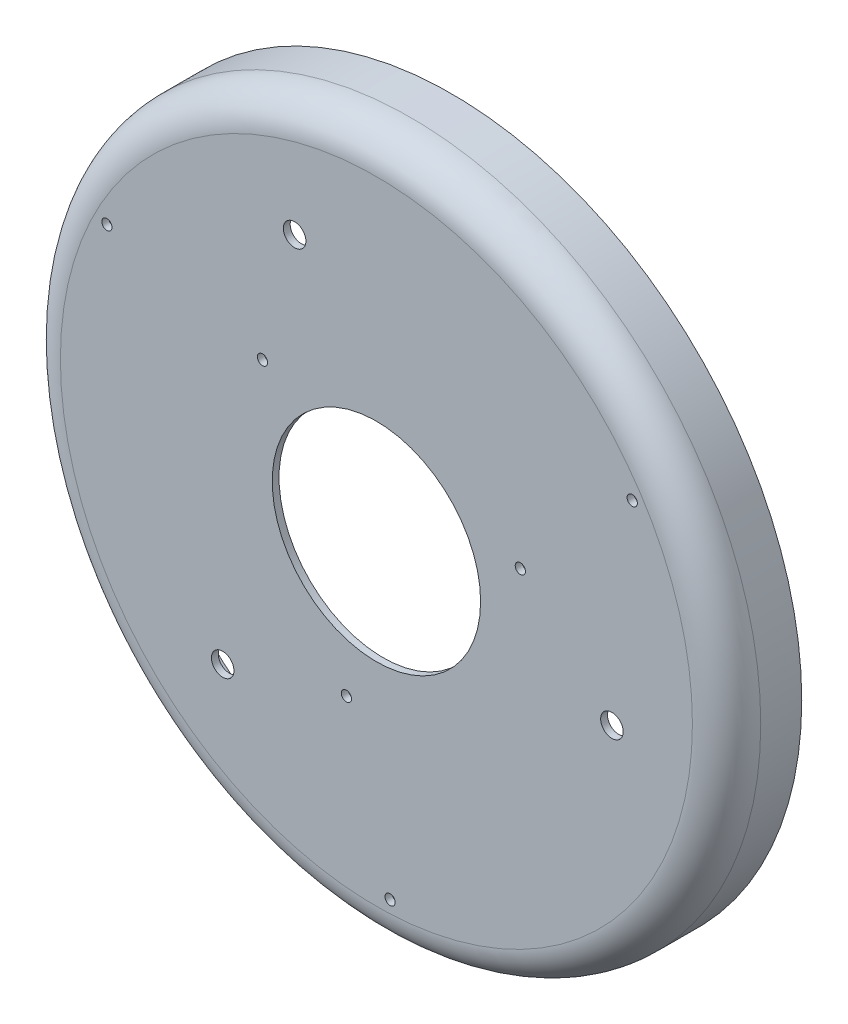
SolidWorks part; units mm, degrees
ref_plane "Face" through (0, 0, 0) normal (0, 0, 1) x (1, 0, 0)
ref_plane "Dessus" through (0, 0, 0) normal (0, 1, 0) x (1, 0, 0)
ref_plane "Droite" through (0, 0, 0) normal (1, 0, 0) x (0, 0, -1)
sketch "Esquisse1" plane through (0, 0, 0) normal (0, 0, 1) x (1, 0, 0)
  circle A0 centre (0, 0) radius 105
  dimension "D1" = 210
extrude "Extrusion1" add sketch "Esquisse1" along normal blind 30
sketch "Esquisse6" plane through (0, 0, 30) normal (0, 0, 1) x (1, 0, 0)
  circle A0 centre (0, 0) radius 102.5
  dimension "D1" = 205
extrude "Extrusion4" cut sketch "Esquisse6" against normal through all flip side to cut
sketch "Esquisse2" plane through (0, 0, 30) normal (0, 0, 1) x (1, 0, 0)
  circle A0 centre (0, 0) radius 30.5
  dimension "D1" = 61
extrude "Extrusion2" cut sketch "Esquisse2" against normal through all
sketch "Esquisse3" plane through (0, 0, 30) normal (0, 0, 1) x (1, 0, 0)
  line L0 (0, 0) -> (-23.9414, 65.7785) construction
  line L1 (0, 0) -> (68.9365, -12.1554) construction
  line L2 (0, 0) -> (-44.9951, -53.6231) construction
  line L3 (0, 0) -> (0, 145.616) construction
  circle A0 centre (0, 0) radius 70 construction
  dimension "D1" = 140
  dimension "D2" = 120
  dimension "D3" = 120
  dimension "D4" = 20
fillet "Congé1" radius 10 1 edges at (102.5, 0, 30)
shell "Coque1" thickness 2
sketch "Esquisse7" plane through (0, 0, 0) normal (0, 0, -1) x (-1, 0, 0)
  circle A0 centre (0, 0) radius 45.8854
extrude "Extrusion5" cut sketch "Esquisse7" against normal up to surface (28 mm away)
hole_wizard "Dégagement M61" positions "Esquisse3D1" profile "Esquisse5" hole size "M6" standard "Ansi Métrique"
sketch3d "Esquisse3D1"
  point P0 (-44.9951, -53.6231, 30)
  point P3 (-23.9414, 65.7785, 30)
  point P6 (68.9365, -12.1554, 30)
sketch "Esquisse5" plane through (-44.9951, -53.6231, 30) normal (1, 0, 0) x (0, -1, 0)
  line L0 (0, 0) -> (0, 30)
  line L1 (0, 30) -> (3.3, 30)
  line L2 (3.3, 30) -> (3.3, 0)
  line L5 (3.3, 0) -> (0, 0)
  line L11 (0, -6.35) -> (0, 107.95) construction
  dimension "Diamètre du perçage jusqu'au prochain" = 6.6
  dimension "Profondeur du perçage jusqu'au prochain" = 30
sketch "Esquisse8" plane through (0, 0, 0) normal (0, 1, 0) x (1, 0, 0)
  line L0 (102.5, 0) -> (102.5, -20)
  line L3 (0, 0) -> (0, -60.3007) construction
  arc A0 (92.5, -30) -> (102.5, -20) centre (92.5, -20) ccw construction
  arc A1 (92.5, -30) -> (102.5, -20) centre (92.5, -20) ccw
revolve "Révol.-Mince1" add sketch "Esquisse8" angle 360 about L3
sketch "Esquisse9" plane through (0, 0, 30) normal (0, 0, 1) x (1, 0, 0)
  line L0 (74.8758, 47.856) -> (0, 0) construction
  circle A0 centre (74.8758, 47.856) radius 1.5
  circle A1 centre (0, 0) radius 88.8627 construction
  dimension "D1" = 3
extrude "Enlèv. mat.-Extru.1" cut sketch "Esquisse9" against normal blind 3
pattern_circular "Répétition circulaire2" count 3 over 360 about axis through (0, 0, 0) along (0, 0, 1) of "Enlèv. mat.-Extru.1"
sketch "Esquisse10" plane through (0, 0, 30) normal (0, 0, 1) x (1, 0, 0)
  circle A0 centre (-33.3475, 29.3943) radius 1.5
extrude "Enlèv. mat.-Extru.2" cut sketch "Esquisse10" against normal blind 3
pattern_circular "Répétition circulaire3" count 3 over 360 about axis through (0, 0, 0) along (0, 0, 1) of "Enlèv. mat.-Extru.2"
sketch "Esquisse11" plane through (0, 0, 0) normal (0, 0, -1) x (-1, 0, 0)
  line L1 (254.1786, -168.1005) -> (-189.4249, -168.1005)
  line L2 (254.1786, -168.1005) -> (254.1786, 226.1042)
  line L3 (254.1786, 226.1042) -> (-189.4249, 226.1042)
  line L4 (-189.4249, -168.1005) -> (-189.4249, 226.1042)
extrude "Extrusion6" cut sketch "Esquisse11" against normal blind 8
